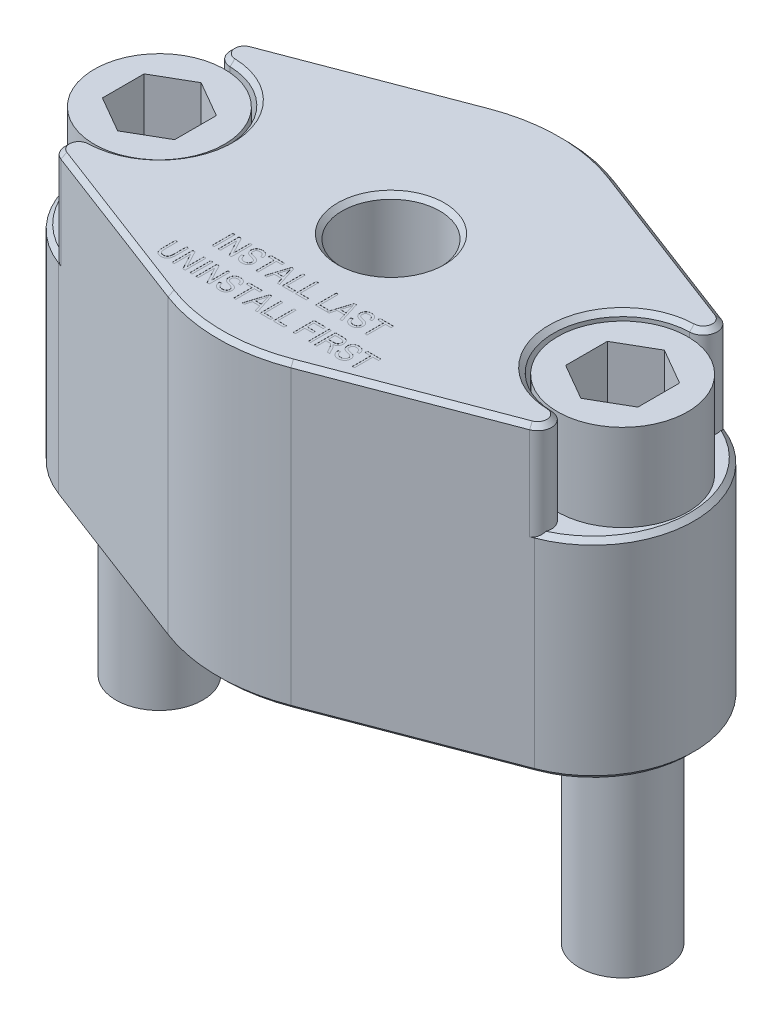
SolidWorks part; units mm, degrees
other "<SHCS37-16L1.75>-<HEX>"
ref_plane "Front Plane" through (0, 0, 0) normal (0, 0, 1) x (1, 0, 0)
ref_plane "Top Plane" through (0, 0, 0) normal (0, 1, 0) x (1, 0, 0)
ref_plane "Right Plane" through (0, 0, 0) normal (1, 0, 0) x (0, 0, -1)
sketch "Sketch1" plane through (0, 0, 0) normal (0, 1, 0) x (1, 0, 0)
  line L0 (-6.7324, 17.7121) -> (-26.0962, 10.3518)
  line L1 (-26.0962, -10.3518) -> (-6.7324, -17.7121)
  line L2 (6.7324, -17.7121) -> (26.0962, -10.3518)
  line L3 (26.0962, 10.3518) -> (6.7324, 17.7121)
  line L4 (-22.1615, 0) -> (22.1615, 0) construction
  line L5 (0, 0) -> (0, 22.9186) construction
  arc A0 (-6.7324, -17.7121) -> (6.7324, -17.7121) centre (0, 0) ccw
  arc A1 (-26.0962, 10.3518) -> (-26.0962, -10.3518) centre (-22.1615, 0) ccw
  arc A2 (26.0962, -10.3518) -> (26.0962, 10.3518) centre (22.1615, 0) ccw
  arc A3 (6.7324, 17.7121) -> (-6.7324, 17.7121) centre (0, 0) ccw
  circle A4 centre (-25.4, 0) radius 5.1435
  circle A5 centre (25.4, 0) radius 5.1435
  dimension "D1" = 37.8968
  dimension "D2" = 11.0744
  dimension "D3" = 66.4718
  dimension "D5" = 25.4
  dimension "D6" = 10.287
  dimension "D4" = 20.812
extrude "Boss-Extrude1" add sketch "Sketch1" along normal blind 33.0708
sketch "Sketch2" plane through (0, 0, 0) normal (0, -1, 0) x (1, 0, 0)
  circle A0 centre (0, 0) radius 16.002
  dimension "D1" = 32.004
extrude "Cut-Extrude1" cut sketch "Sketch2" against normal blind 15.875
fillet "Fillet1" radius 0.508 1 edges at (0, 15.875, -16.002)
sketch "Sketch3" plane through (0, 33.0708, 0) normal (0, 1, 0) x (1, 0, 0)
  line L0 (-25.4, 7.5565) -> (-33.2359, 7.5565)
  line L1 (-33.2359, 7.5565) -> (-33.2359, -7.5565)
  line L2 (-33.2359, -7.5565) -> (-25.4, -7.5565)
  line L3 (25.4, 7.5565) -> (33.2359, 7.5565)
  line L4 (33.2359, 7.5565) -> (33.2359, -7.5565)
  line L5 (33.2359, -7.5565) -> (25.4, -7.5565)
  arc A0 (-25.4, -7.5565) -> (-25.4, 7.5565) centre (-25.4, 0) ccw
  arc A1 (25.4, 7.5565) -> (25.4, -7.5565) centre (25.4, 0) ccw
  arc A2 (-26.0962, 10.3518) -> (-26.0962, -10.3518) centre (-22.1615, 0) ccw construction
  arc A3 (26.0962, -10.3518) -> (26.0962, 10.3518) centre (22.1615, 0) ccw construction
  dimension "D1" = 15.113
extrude "Cut-Extrude2" cut sketch "Sketch3" against normal blind 10.16
hole_wizard "1/2-13 Tapped Hole1" positions "Sketch4" profile "Sketch5" tap size "1/2-13" standard "ANSI Inch"
sketch "Sketch4" plane through (0, 33.0708, 0) normal (0, 1, 0) x (1, 0, 0)
  point P0 (0, 0)
sketch "Sketch5" plane through (0, 33.0708, 0) normal (1, 0, 0) x (0, 0, 1)
  line L0 (0, 0) -> (0, 33.0708)
  line L1 (0, 33.0708) -> (5.3581, 33.0708)
  line L2 (5.3581, 33.0708) -> (5.3581, 0)
  line L5 (5.3581, 0) -> (0, 0)
  line L11 (0, -6.35) -> (0, 107.95) construction
  dimension "Thru Tap Drill Dia." = 10.7163
  dimension "Thru Tap Drill Depth" = 33.0708
fillet "Fillet2" radius 1.524 4 edges at (30.2573, 27.9908, -7.5565) (30.2573, 27.9908, 7.5565) (-30.2573, 27.9908, 7.5565) (-30.2573, 27.9908, -7.5565)
chamfer "Chamfer1" distance 0.508 angle 45 30 edges at (16.2169, 33.0708, -14.107) (16.2169, 33.0708, 14.107) (0, 33.0708, 18.9484) (-16.2169, 33.0708, 14.107) (-16.2169, 33.0708, -14.107) (0, 33.0708, -18.9484) (17.8435, 33.0708, 0) (-17.8435, 33.0708, 0) (0, 33.0708, 5.3581) (25.4, 0, 5.1435) (0, 0, -16.002) (-25.4, 0, 5.1435) (16.4143, 0, -14.0319) (0, 0, -18.9484) (33.2359, 0, 0) (-16.4143, 0, -14.0319) (16.4143, 0, 14.0319) (-33.2359, 0, 0) (0, 0, 18.9484) (-16.4143, 0, 14.0319) (26.6624, 33.0708, 8.8219) (-26.6624, 33.0708, 8.8219) (-26.6624, 33.0708, -8.8219) (26.6624, 33.0708, -8.8219) (25.8988, 22.9108, 10.4269) (25.8988, 22.9108, -10.4269) (33.2359, 22.9108, 0) (-25.8988, 22.9108, -10.4269) (-25.8988, 22.9108, 10.4269) (-33.2359, 22.9108, 0)
sketch "Sketch6" plane through (0, 33.0708, 0) normal (0, 1, 0) x (1, 0, 0)
  line L0 (-12.7, -10.922) -> (12.7, -10.922) construction
  line L1 (0, 18.4404) -> (0, -18.9484) construction
  line L3 (-12.7, -14.732) -> (12.7, -14.732) construction
  arc A0 (6.5519, 17.2372) -> (-6.5519, 17.2372) centre (0, 0) ccw construction
  arc A1 (-6.7324, -17.7121) -> (6.7324, -17.7121) centre (0, 0) ccw construction
  text T0 "INSTALL LAST" font "Arial Narrow" height 2.286
  text T2 "UNINSTALL FIRST" font "Arial Narrow" height 2.286
  point P14 (0, -10.922)
  dimension "D2" = 25.4
  dimension "D5" = 10.922
  dimension "D6" = 14.732
extrude "Cut-Extrude3" cut sketch "Sketch6" against normal blind 0.0127
inserted part "SHCS37-16L1.75"
move or copy body "Body-Move/Copy2" placed by mates yes parameters "D1"=0, "D2"=0, "D3"=0
mirror "Mirror1" about plane through (0, 0, 0) normal (1, 0, 0)
